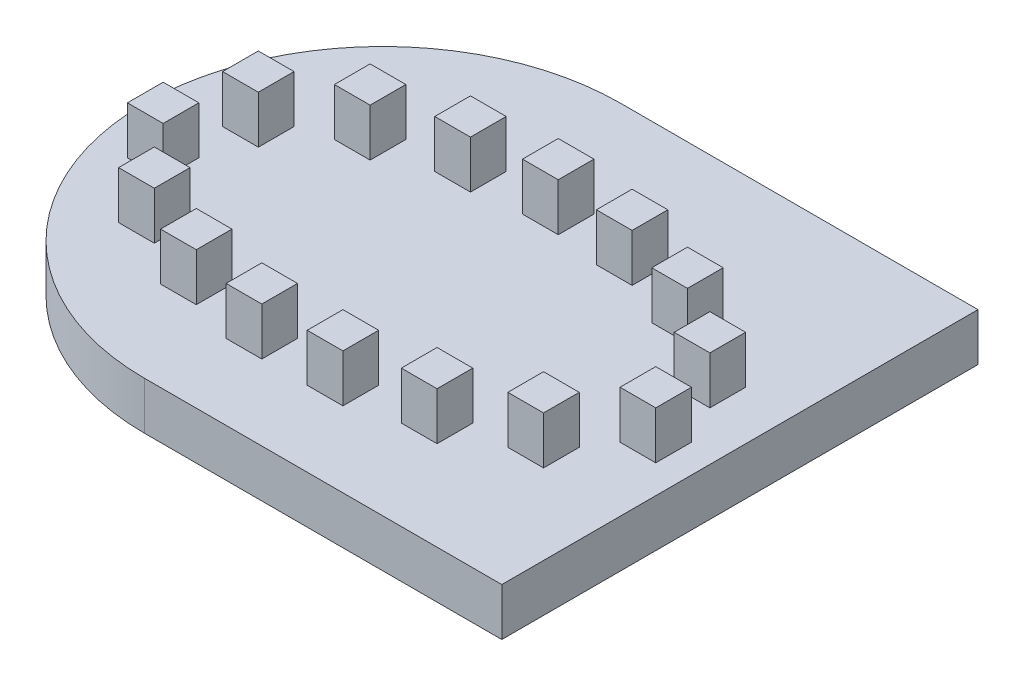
SolidWorks part; units mm, degrees
ref_plane "Front" through (0, 0, 0) normal (0, 0, 1) x (1, 0, 0)
ref_plane "Top" through (0, 0, 0) normal (0, 1, 0) x (1, 0, 0)
ref_plane "Right" through (0, 0, 0) normal (1, 0, 0) x (0, 0, -1)
sketch "Sketch1" plane through (0, 0, 0) normal (0, 1, 0) x (1, 0, 0)
  line L0 (75, -100) -> (-75, 100) construction
  line L1 (-75, 100) -> (75, 100)
  line L3 (-75, -100) -> (75, -100)
  line L4 (75, 100) -> (75, -100)
  arc A0 (-75, 100) -> (-75, -100) centre (-75, 0) ccw
  dimension "D1" = 150
  dimension "D2" = 200
extrude "Extrude1" add sketch "Sketch1" along normal blind 20
sketch "Sketch2" plane through (0, 20, 0) normal (0, 1, 0) x (-1, 0, 0)
  ellipse E0 centre (47.8826, 0) end of major axis (152.5978, 0) minor radius 54.09 construction
sketch "Sketch3" plane through (0, 20, 0) normal (0, 1, 0) x (-1, 0, 0)
  line L1 (55.3826, -54.09) -> (40.3826, -54.09)
  line L2 (55.3826, -54.09) -> (55.3826, -39.09)
  line L3 (55.3826, -39.09) -> (40.3826, -39.09)
  line L4 (40.3826, -54.09) -> (40.3826, -39.09)
  dimension "D1" = 15
  dimension "D2" = 15
extrude "Extrude2" add sketch "Sketch3" along normal blind 20
pattern_curve "CrvPattern1" of "Extrude2" parameters "D1"=15, "D3"=100, "D2"=1, "D4"=10
